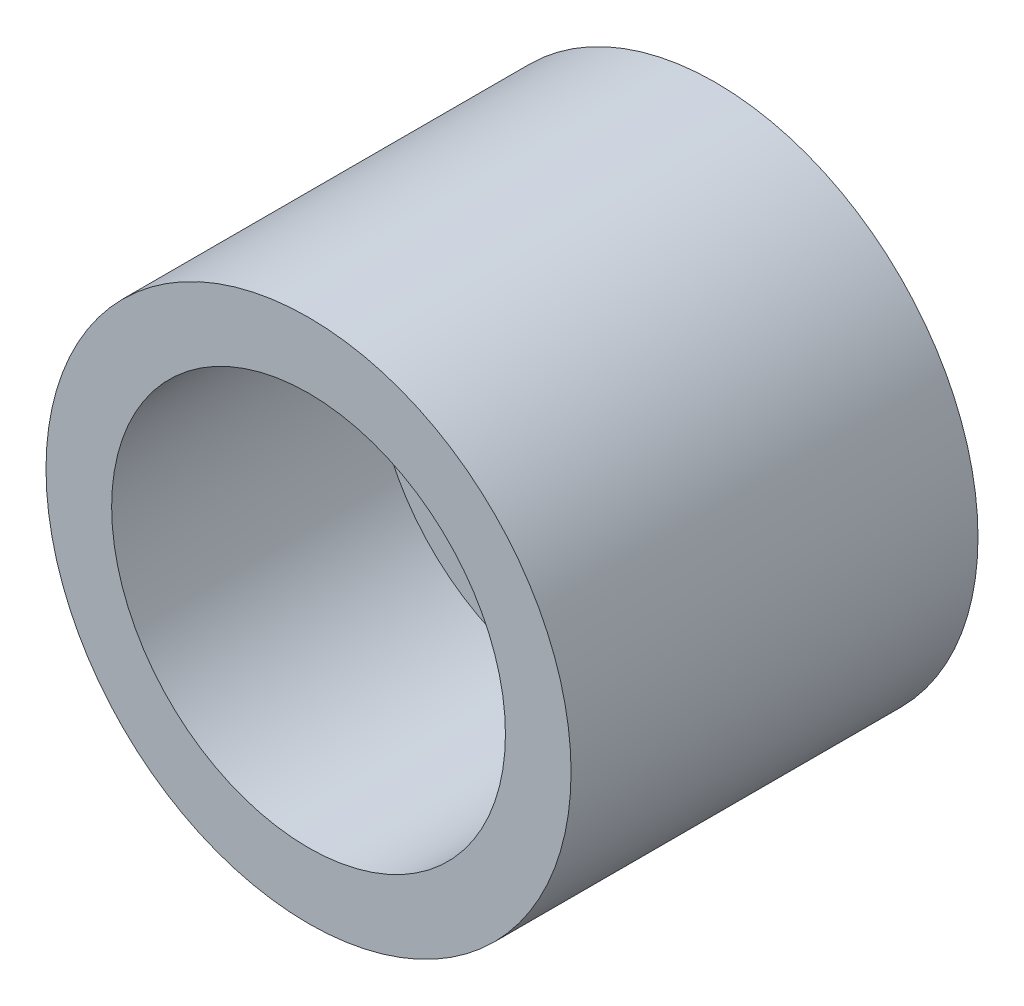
SolidWorks part; units mm, degrees
ref_plane "Face" through (0, 0, 0) normal (0, 0, 1) x (1, 0, 0)
ref_plane "Dessus" through (0, 0, 0) normal (0, 1, 0) x (1, 0, 0)
ref_plane "Droite" through (0, 0, 0) normal (1, 0, 0) x (0, 0, -1)
sketch "Esquisse2" plane through (0, 0, 0) normal (0, 0, 1) x (1, 0, 0)
  circle A0 centre (0, 0) radius 10
  dimension "D1" = 20
extrude "Extrusion2" add sketch "Esquisse2" along normal blind 15.5
hole_wizard "Chambrage pour vis à tête hexagonale M81" positions "Esquisse4" profile "Esquisse3" counterbore size "M8" standard "ISO"
sketch "Esquisse4" plane through (0, 0, 15.5) normal (0, 0, 1) x (1, 0, 0)
  point P1 (0, 0)
sketch "Esquisse3" plane through (0, 0, 15.5) normal (1, 0, 0) x (0, -1, 0)
  line L0 (0, 0) -> (0, 15.5)
  line L1 (0, 15.5) -> (4.5, 15.5)
  line L3 (4.5, 15.5) -> (4.5, 10)
  line L4 (4.5, 10) -> (7.5, 10)
  line L5 (7.5, 10) -> (7.5, 0)
  line L7 (7.5, 0) -> (0, 0)
  line L11 (0, -6.35) -> (0, 107.95) construction
  dimension "Diamètre du perçage jusqu'au prochain" = 9
  dimension "Profondeur du perçage jusqu'au prochain" = 15.5
  dimension "Diamètre du chambrage" = 15
  dimension "Profondeur du chambrage" = 10
